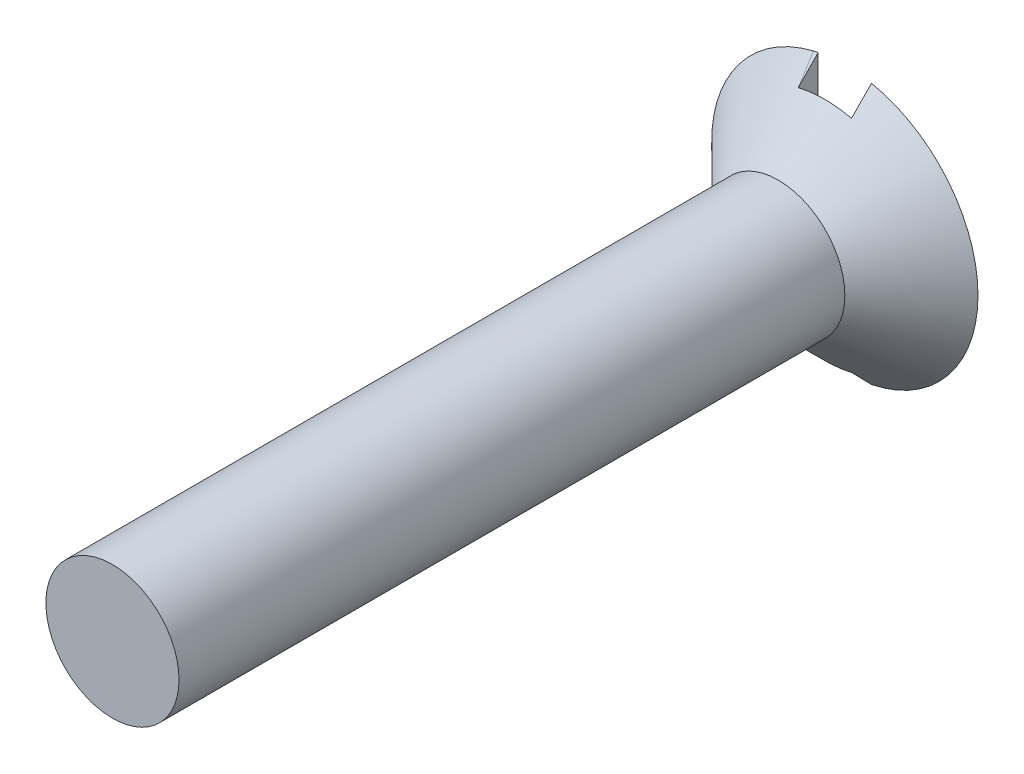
SolidWorks part; units mm, degrees
ref_plane "Front Plane" through (0, 0, 0) normal (0, 0, 1) x (1, 0, 0)
ref_plane "Top Plane" through (0, 0, 0) normal (0, 1, 0) x (1, 0, 0)
ref_plane "Right Plane" through (0, 0, 0) normal (1, 0, 0) x (0, 0, -1)
sketch "Sketch1" plane through (0, 0, 0) normal (0, 0, 1) x (1, 0, 0)
  circle A0 centre (0, 0) radius 2
extrude "Extrude1" add sketch "Sketch1" against normal blind 1
chamfer "Chamfer1" distance 1 angle 45 1 edges at (2, 0, 0)
sketch "Sketch2" plane through (0, 0, 0) normal (0, 0, 1) x (1, 0, 0)
  circle A0 centre (0, 0) radius 1
extrude "Extrude3" add sketch "Sketch2" along normal blind 10
sketch "Sketch3" plane through (0, 0, -1) normal (0, 0, -1) x (-1, 0, 0)
  line L0 (0, 2) -> (0, -2) construction
  line L3 (-0.4, 1.9596) -> (-0.4, -1.9596)
  line L4 (0.4, 1.9596) -> (0.4, -1.9596)
  circle A0 centre (0, 0) radius 2 construction
extrude "Cut-Extrude1" cut sketch "Sketch3" against normal blind 0.3
